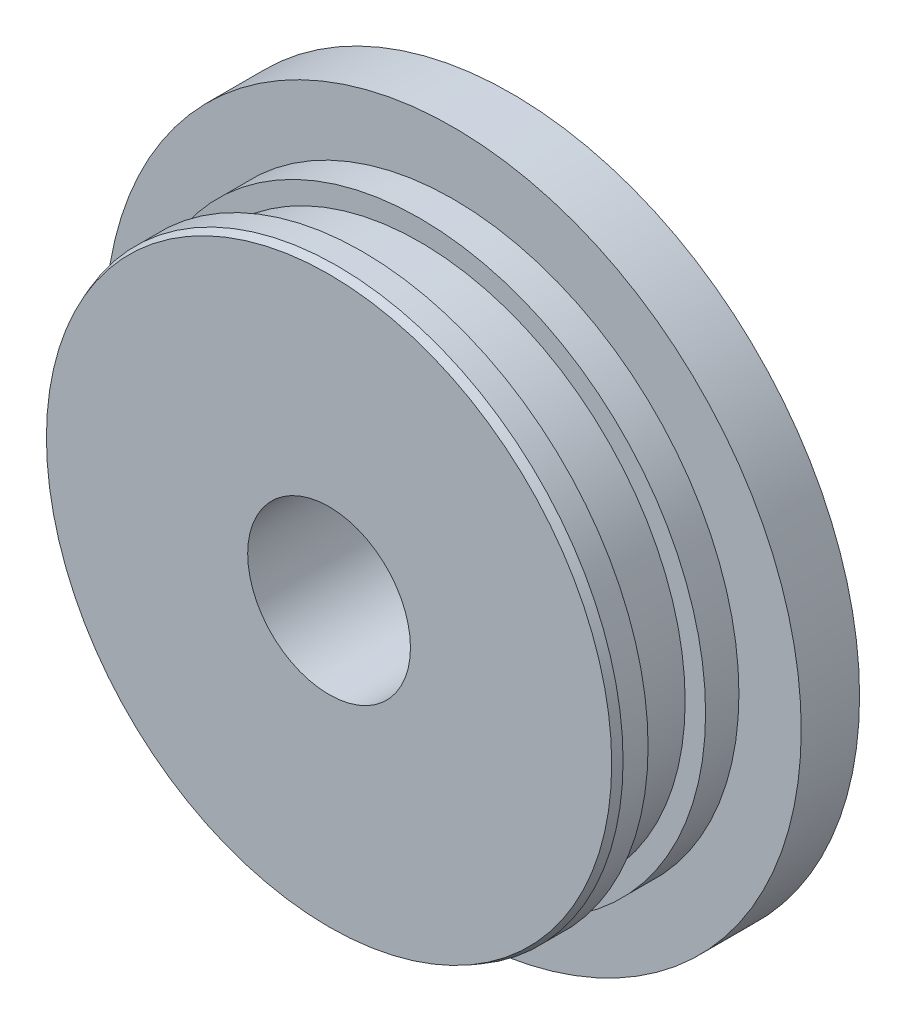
SolidWorks part; units mm, degrees
ref_plane "Plane1" through (0, 0, 0) normal (0, 0, 1) x (1, 0, 0)
ref_plane "Plane2" through (0, 0, 0) normal (0, 1, 0) x (1, 0, 0)
ref_plane "Plane3" through (0, 0, 0) normal (1, 0, 0) x (0, 0, -1)
sketch "Sketch1" plane through (0, 0, 0) normal (0, 0, 1) x (1, 0, 0)
  circle A0 centre (0, 0) radius 21.209
  dimension "D1" = 42.418
extrude "ortman_plug" add sketch "Sketch1" along normal blind 1.27
sketch "Sketch2" plane through (0, 0, 1.27) normal (0, 0, 1) x (1, 0, 0)
  circle A0 centre (0, 0) radius 21.209
  dimension "D1" = 42.418
extrude "ortman_groove" add sketch "Sketch2" along normal blind 1.27
sketch "Sketch3" plane through (0, 0, 2.54) normal (0, 0, 1) x (1, 0, 0)
  circle A0 centre (0, 0) radius 21.209
  dimension "D1" = 42.418
extrude "ortman_plug2" add sketch "Sketch3" along normal blind 1.016
sketch "Sketch4" plane through (0, 0, 3.556) normal (0, 0, 1) x (1, 0, 0)
  circle A0 centre (0, 0) radius 17.4117
  dimension "D1" = 34.8234
extrude "oring_boss" add sketch "Sketch4" along normal blind 2.032
sketch "Sketch5" plane through (0, 0, 5.588) normal (0, 0, 1) x (1, 0, 0)
  circle A0 centre (0, 0) radius 16.1671
  dimension "D1" = 32.3342
extrude "oring_groove" add sketch "Sketch5" along normal blind 3.5052
sketch "Sketch6" plane through (0, 0, 9.0932) normal (0, 0, 1) x (1, 0, 0)
  circle A0 centre (0, 0) radius 17.4117
  dimension "D1" = 34.8234
extrude "oring_boss2" add sketch "Sketch6" along normal blind 2.032
chamfer "Chamfer2" distance 0.508 angle 20 1 edges at (17.4117, 0, 11.1252)
sketch "Sketch21" plane through (8.8157, 8.0471, 0) normal (0, 0, -1) x (-1, 0, 0)
  circle A0 centre (8.8157, -8.0471) radius 4.9606
  dimension "D1" = 9.9212
extrude "thru_hole" cut sketch "Sketch21" against normal blind 25.4
sketch "Sketch31" plane through (0, 0, 0) normal (0, 0, -1) x (-1, 0, 0)
  circle A0 centre (0, 0) radius 10.5156
  dimension "D1" = 21.0312
extrude "land" cut sketch "Sketch31" against normal blind 0.0508
sketch "Sketch41" plane through (0, 0, 0.0508) normal (0, 0, -1) x (-1, 0, 0)
  circle A0 centre (0, 0) radius 6.1849
  dimension "D1" = 12.3698
extrude "12_deg_chamfer" cut sketch "Sketch41" against normal blind 2.3622 draft 12
sketch "Sketch51" plane through (0, 0, 2.413) normal (0, 0, -1) x (-1, 0, 0)
  circle A0 centre (0, 0) radius 5.6828
  dimension "D1" = 11.3656
extrude "45_deg_chamfer" cut sketch "Sketch51" against normal blind 2.54 draft 45
other "boss_7161"
equation "\"D1@Sketch2\" = \"D1@Sketch1\""
equation "\"D1@Sketch3\" = \"D1@Sketch1\""
